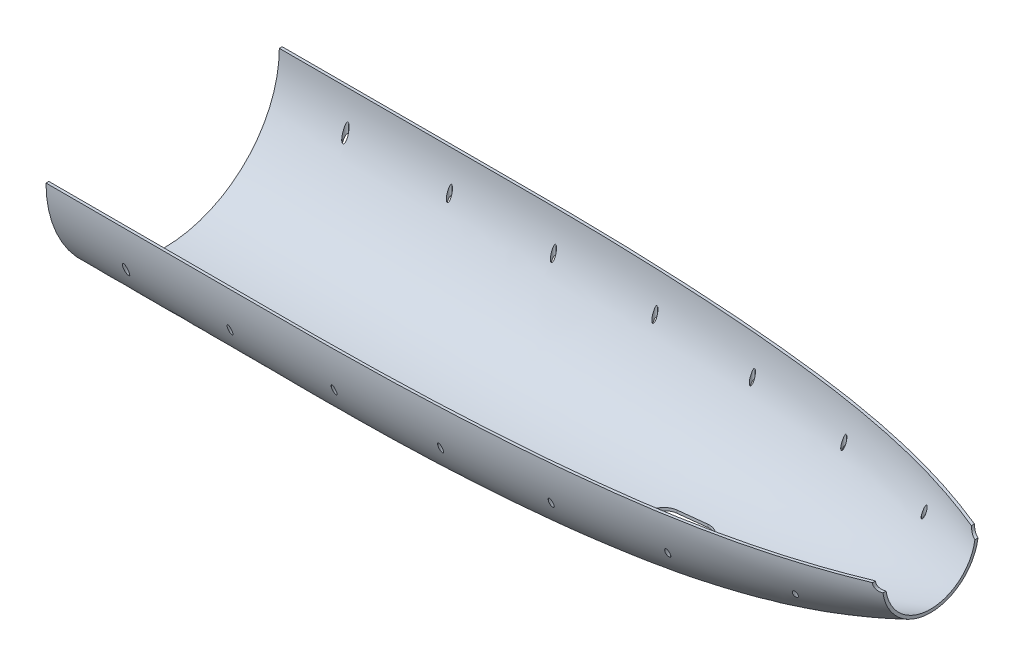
SolidWorks part; units mm, degrees
other "<1 TAIL SHELL BASE PART>-<<0 SERIES 58 EXTENDED SHELL>-<Form Shell>>"
ref_plane "FRONT" through (0, 0, 0) normal (0, 0, 1) x (1, 0, 0)
ref_plane "TOP" through (0, 0, 0) normal (0, 1, 0) x (1, 0, 0)
ref_plane "SIDE" through (0, 0, 0) normal (1, 0, 0) x (0, 0, -1)
inserted part "1 TAIL SHELL BASE PART"
ref_plane "Plane1" through (609.6, 0, 0) normal (1, 0, 0) x (0, 0, -1)
sketch "Sketch2" [suppressed] plane through (609.6, 0, 0) normal (1, 0, 0) x (0, 0, -1)
  line L0 (0, 0) -> (246.4978, -246.4978) construction
  line L1 (0, 0) -> (266.7001, 0) construction
  line L2 (139.7, -139.7) -> (271.78, -271.78)
  line L3 (271.78, -271.78) -> (307.701, -235.859)
  line L4 (307.701, -235.859) -> (175.621, -103.779)
  line L5 (139.7, -139.7) -> (175.621, -103.779)
  dimension "D1" = 45
  dimension "D2" = 101.6
revolve "GasCap" [suppressed] cut sketch "Sketch2" angle 360 about L0
sketch "Sketch3" plane through (0, 0, 0) normal (0, 1, 0) x (1, 0, 0)
  line L0 (-635, 260.35) -> (-635, -260.35) construction
  arc A0 (14.4985, -15.1995) -> (14.4985, 15.1995) centre (34.8488, 0) ccw
  arc A1 (14.4985, 15.1995) -> (-65.151, -0.0014) centre (-23.876, 0) ccw
  arc A3 (-65.151, -0.0014) -> (14.4985, -15.1995) centre (-23.876, 0) ccw
  dimension "D1" = 50.8
  dimension "D2" = 611.124
  dimension "D3" = 41.275
  dimension "D4" = 58.7248
  dimension "D5" = 23.876
extrude "Antenna/Strobe" [suppressed] cut sketch "Sketch3" against normal through all
sketch "Sketch4" [suppressed] plane through (0, 0, 0) normal (0, 1, 0) x (1, 0, 0)
  line L0 (-101.6, 260.35) -> (-101.6, -260.35) construction
  circle A0 centre (158.75, 0) radius 25.4
  dimension "D1" = 50.8
  dimension "D2" = 260.35
extrude "Sphere top" [suppressed] cut sketch "Sketch4" against normal through all
sketch "Sketch5" plane through (0, 0, 0) normal (0, 1, 0) x (1, 0, 0)
  line L0 (482.2518, 41.272) -> (552.2415, 41.2716)
  line L1 (482.3543, -41.2779) -> (552.1382, -41.2782)
  arc A0 (482.2518, 41.272) -> (482.3543, -41.2779) centre (482.2516, -0.003) ccw
  arc A1 (552.1382, -41.2782) -> (552.2415, 41.2716) centre (552.2413, -0.0034) ccw
  dimension "D1" = 82.55
  dimension "D2" = 82.55
extrude "Cut-Extrude1" cut sketch "Sketch5" against normal through all
sketch "Sketch6" [suppressed] plane through (0, 0, 0) normal (0, 1, 0) x (1, 0, 0)
  line L2 (552.2413, -0.0034) -> (410.6517, -0.0034) construction
  line L3 (482.2516, 40.6366) -> (552.2413, 40.6366)
  line L4 (482.2516, -40.6434) -> (552.2413, -40.6434)
  arc A4 (482.2516, 40.6366) -> (482.2516, -40.6434) centre (482.2516, -0.0034) ccw
  arc A6 (552.2413, -40.6434) -> (552.2413, 40.6366) centre (552.2413, -0.0034) ccw
extrude "Cut-Extrude2" [suppressed] cut sketch "Sketch6" against normal through all
sketch "Sketch7" plane through (0, 0, 0) normal (0, 1, 0) x (1, 0, 0)
  circle A2 centre (-473.075, 247.6509) radius 5.8547
  circle A3 centre (-473.075, 247.6509) radius 5.8547
  circle A5 centre (-3.175, 247.6509) radius 4.9022
  circle A6 centre (-3.175, 247.6509) radius 4.9022
  circle A8 centre (231.775, 241.9424) radius 4.9022
  circle A9 centre (231.775, 241.9424) radius 4.9022
  circle A11 centre (466.725, 227.1703) radius 4.9022
  circle A12 centre (466.725, 227.1703) radius 4.9022
  circle A14 centre (701.675, 198.8036) radius 4.9022
  circle A15 centre (701.675, 198.8036) radius 4.9022
  circle A17 centre (936.625, 145.3725) radius 4.9022
  circle A18 centre (936.625, 145.3725) radius 4.9022
  circle A20 centre (-238.125, -247.6509) radius 4.9022
  circle A21 centre (-238.125, -247.6509) radius 4.9022
  dimension "D1" = 3.175
  dimension "D2" = 3.175
  dimension "D3" = 3.175
  dimension "D4" = 3.175
  dimension "D5" = 3.175
  dimension "D6" = 3.175
  dimension "D7" = 3.175
extrude "Cut-Extrude3" cut sketch "Sketch7" against normal through all
mirror "Mirror1" about plane through (0, 0, 0) normal (0, 0, 1) of "Cut-Extrude3"
